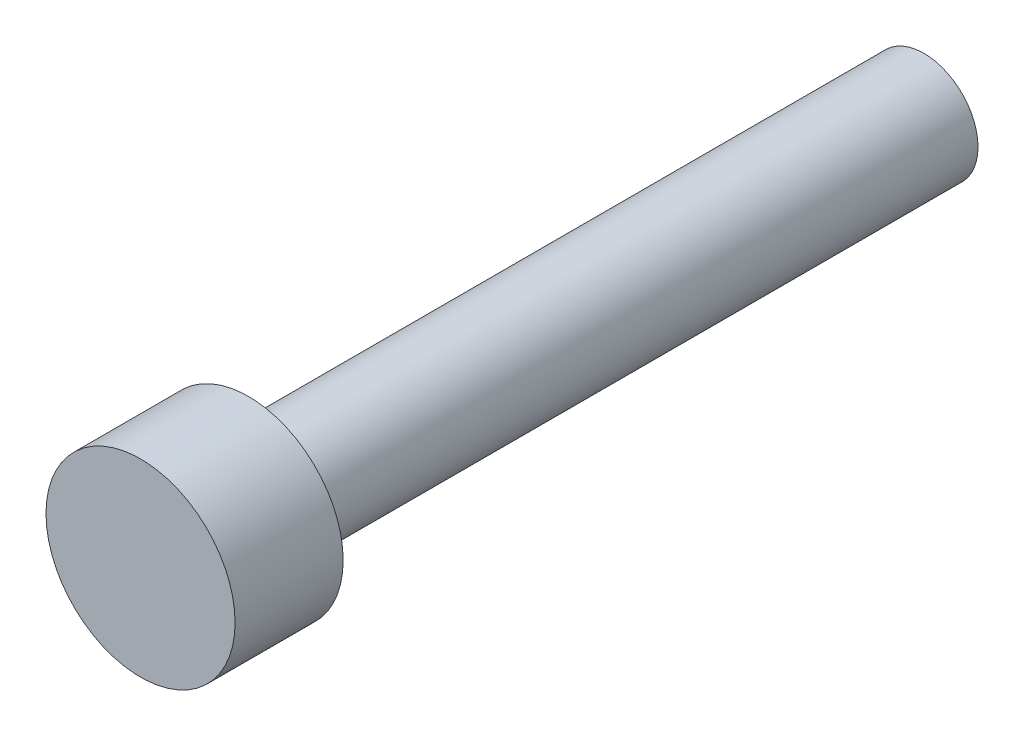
SolidWorks part; units mm, degrees
ref_plane "前视基准面" through (0, 0, 0) normal (0, 0, 1) x (1, 0, 0)
ref_plane "上视基准面" through (0, 0, 0) normal (0, 1, 0) x (1, 0, 0)
ref_plane "右视基准面" through (0, 0, 0) normal (1, 0, 0) x (0, 0, -1)
sketch "草图1" plane through (0, 0, 0) normal (0, 0, 1) x (1, 0, 0)
  circle A0 centre (0, 0) radius 2
  dimension "D1" = 4
extrude "凸台-拉伸1" add sketch "草图1" along normal blind 25
sketch "草图2" plane through (0, 0, 25) normal (0, 0, 1) x (1, 0, 0)
  circle A0 centre (0, 0) radius 3.5
  dimension "D1" = 7
extrude "凸台-拉伸2" add sketch "草图2" along normal blind 4
